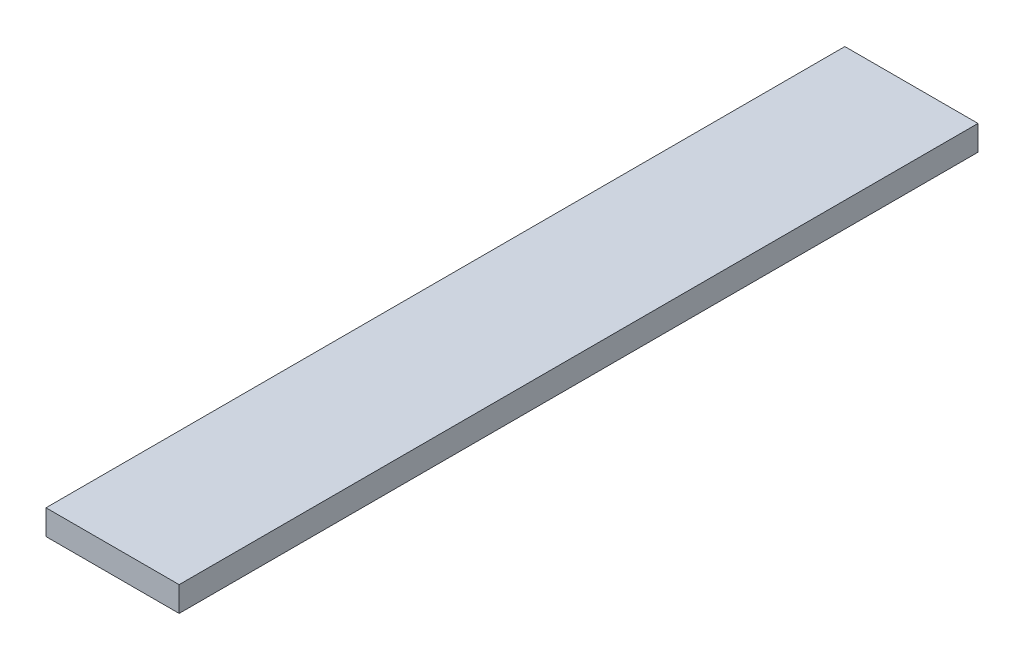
SolidWorks part; units mm, degrees
ref_plane "Front Plane" through (0, 0, 0) normal (0, 0, 1) x (1, 0, 0)
ref_plane "Top Plane" through (0, 0, 0) normal (0, 1, 0) x (1, 0, 0)
ref_plane "Right Plane" through (0, 0, 0) normal (1, 0, 0) x (0, 0, -1)
sketch "Sketch1" plane through (0, 0, 0) normal (0, 1, 0) x (1, 0, 0)
  line L1 (-6.35, -38.1) -> (6.35, -38.1)
  line L2 (-6.35, -38.1) -> (-6.35, 38.1)
  line L3 (-6.35, 38.1) -> (6.35, 38.1)
  line L4 (6.35, -38.1) -> (6.35, 38.1)
  line L5 (-6.35, -38.1) -> (6.35, 38.1) construction
  line L6 (-6.35, 38.1) -> (6.35, -38.1) construction
  point P0 (0, 0)
  dimension "D1" = 76.2
  dimension "D2" = 12.7
extrude "Boss-Extrude1" add sketch "Sketch1" along normal blind 2.3813
